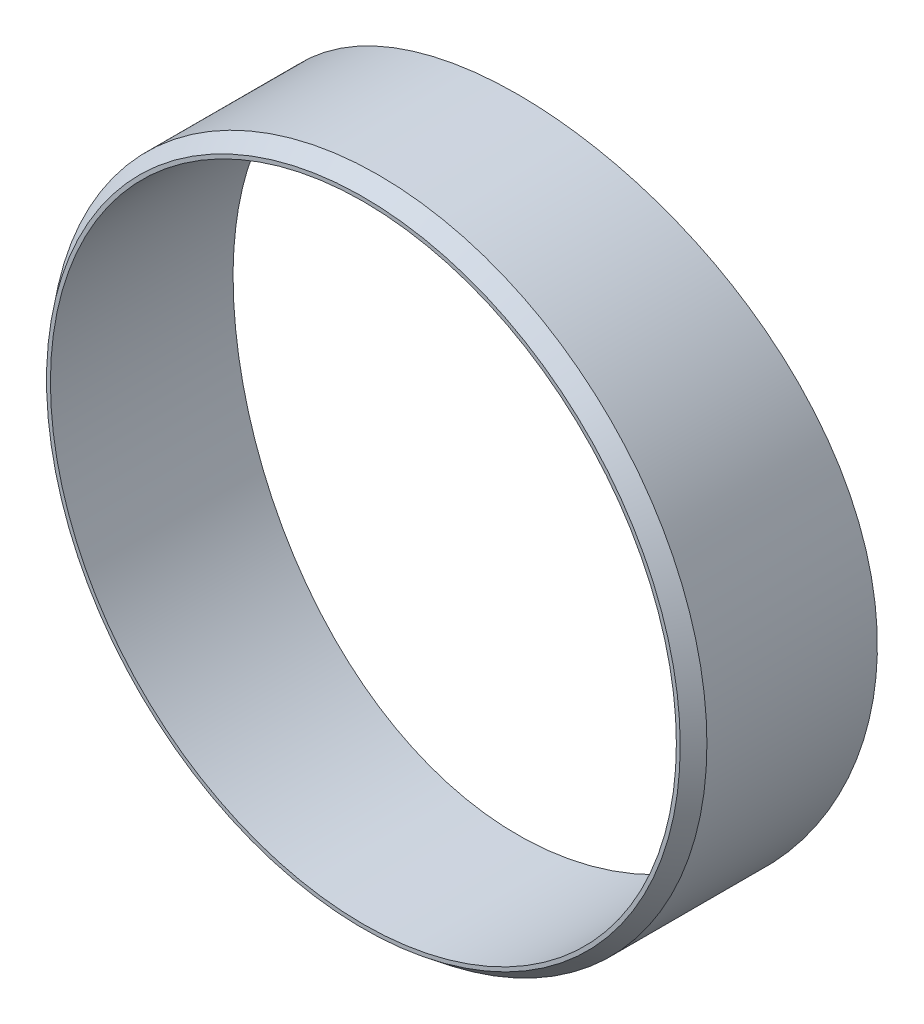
SolidWorks part; units mm, degrees
ref_plane "Front" through (0, 0, 0) normal (0, 0, 1) x (1, 0, 0)
ref_plane "Top" through (0, 0, 0) normal (0, 1, 0) x (1, 0, 0)
ref_plane "Right" through (0, 0, 0) normal (1, 0, 0) x (0, 0, -1)
sketch "Sketch1" plane through (0, 0, 0) normal (0, 0, 1) x (1, 0, 0)
  circle A0 centre (0, 0) radius 134.9375
  circle A1 centre (0, 0) radius 128.5875
  dimension "D1" = 269.875
  dimension "D2" = 6.35
extrude "Extrude1" add sketch "Sketch1" along normal blind 63.5 and the other way blind 177.8
sketch "Sketch3" plane through (0, 0, 0) normal (0, 1, 0) x (1, 0, 0)
  line L0 (-134.9375, -63.5) -> (134.9375, -63.5) construction
  circle A0 centre (0, 720.725) radius 720.725
  point P0 (0, 720.725)
extrude "Cut-Extrude3" cut sketch "Sketch3" against normal through all and the other way through all
sketch "Sketch4" plane through (0, 0, 0) normal (1, 0, 0) x (0, 0, -1)
  line L0 (-104.6722, 0) -> (72.4044, 0) construction
  line L1 (-57.2934, 134.9375) -> (-63.5, 130.175)
  line L2 (0, 134.9375) -> (-63.5, 134.9375) construction
  line L3 (-63.5, 134.9375) -> (-63.5, -134.9375) construction
  line L4 (-63.5, 130.175) -> (-63.5, 134.9375)
  line L5 (-63.5, 134.9375) -> (-57.2934, 134.9375)
  dimension "D1" = 1.5875
  dimension "D2" = 37.5
revolve "Cut-Revolve1" cut sketch "Sketch4" angle 360 about L0
equation "\"D1@Sketch3\" = \"D1@Sketch1@shell 2<1>.Part@Vessel section 2<2>.Assembly\" / 2 + 0.375"
